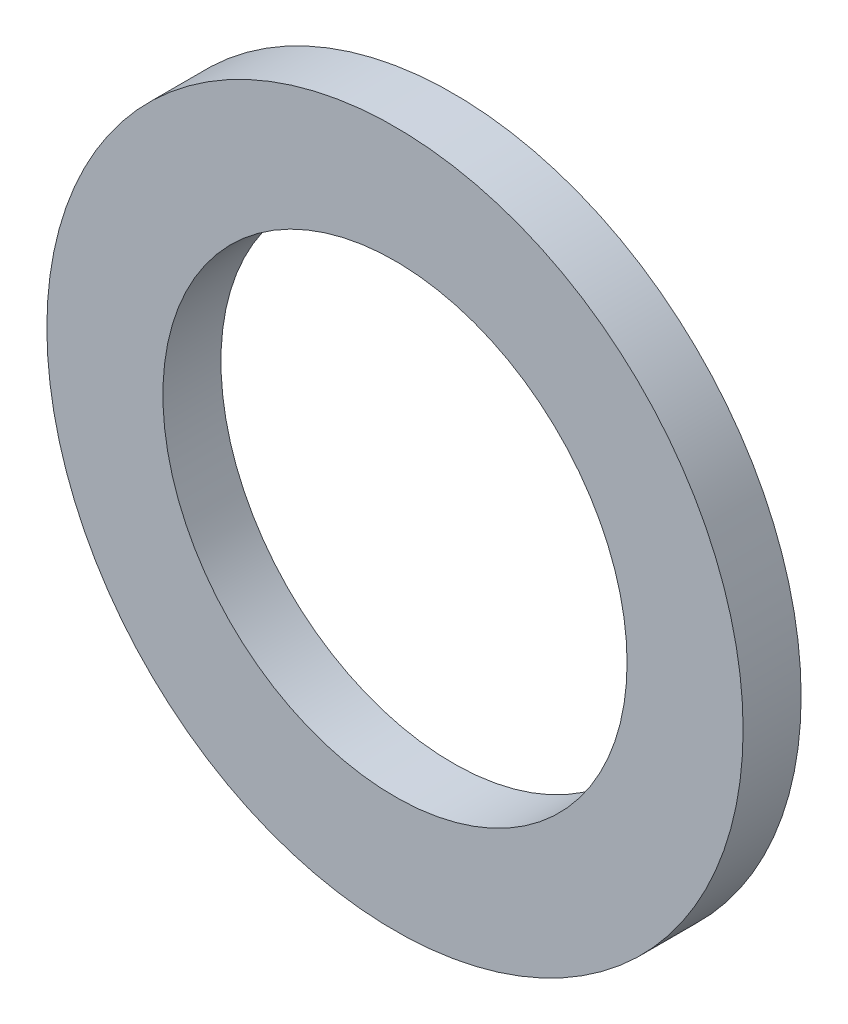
SolidWorks part; units mm, degrees
ref_plane "Face" through (0, 0, 0) normal (0, 0, 1) x (1, 0, 0)
ref_plane "Dessus" through (0, 0, 0) normal (0, 1, 0) x (1, 0, 0)
ref_plane "Droite" through (0, 0, 0) normal (1, 0, 0) x (0, 0, -1)
ref_plane "Plan4" through (0, 0, -0.5) normal (0, 0, -1) x (-1, 0, 0)
sketch "Esquisse1" plane through (0, 0, -0.5) normal (0, 0, -1) x (-1, 0, 0)
  circle A0 centre (0, 0) radius 2
  circle A1 centre (0, 0) radius 3
extrude "Base-Extrusion" add sketch "Esquisse1" against normal blind 0.5
